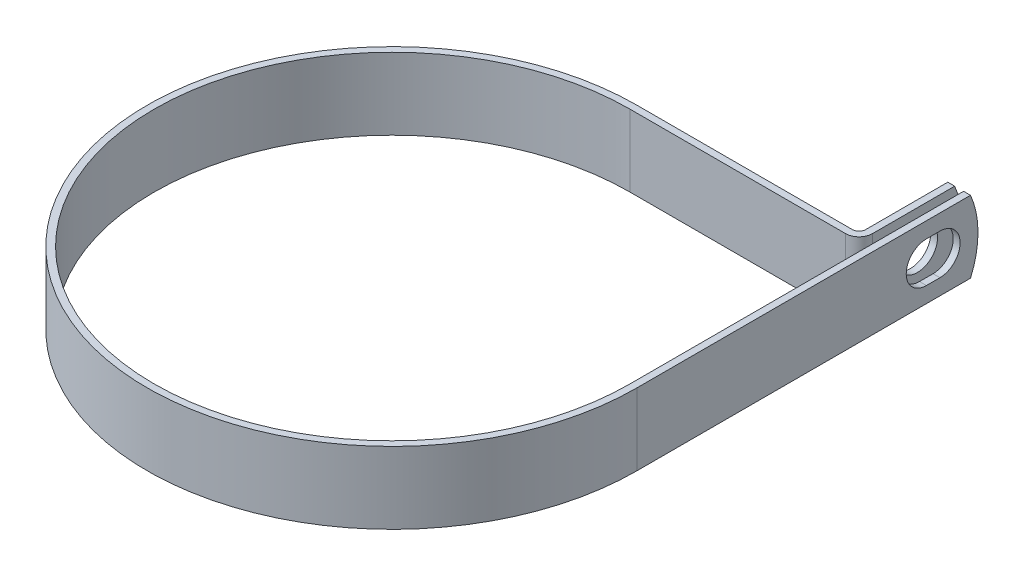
SolidWorks part; units mm, degrees
ref_plane "Front Plane" through (0, 0, 0) normal (0, 0, 1) x (1, 0, 0)
ref_plane "Top Plane" through (0, 0, 0) normal (0, 1, 0) x (1, 0, 0)
ref_plane "Right Plane" through (0, 0, 0) normal (1, 0, 0) x (0, 0, -1)
sketch "Sketch1" plane through (0, 0, 0) normal (0, 1, 0) x (1, 0, 0)
  line L0 (0, 42.0624) -> (38.1102, 42.0624)
  line L1 (42.0624, 0) -> (42.0624, 42.0624)
  line L2 (40.4876, 60.2996) -> (40.4876, 44.4398)
  line L5 (42.0624, 42.0624) -> (42.0624, 60.2996)
  arc A0 (0, 42.0624) -> (42.0624, 0) centre (0, 0) ccw
  arc A3 (38.1102, 42.0624) -> (40.4876, 44.4398) centre (38.1102, 44.4398) ccw
extrude "Extrude-Thin1" add sketch "Sketch1" along normal mid plane 12.7 thin
sketch "Sketch2" plane through (39.2684, 0, 0) normal (-1, 0, 0) x (0, 0, 1)
  line L0 (-60.2996, 6.35) -> (-60.2996, -6.35) construction
  line L7 (0, 6.35) -> (0, -6.35) construction
  circle A0 centre (-52.3748, 0) radius 3.5687
  point P2 (-60.2996, 0)
extrude "Cut-Extrude1" cut sketch "Sketch2" against normal up to surface (1.2192 mm away)
sketch "Sketch3" plane through (43.2816, 0, 0) normal (1, 0, 0) x (0, 0, -1)
  line L0 (51.181, 0) -> (53.5686, 0) construction
  line L1 (51.181, 3.5687) -> (53.5686, 3.5687)
  line L2 (51.181, -3.5687) -> (53.5686, -3.5687)
  line L3 (60.2996, 6.35) -> (60.2996, -6.35) construction
  arc A0 (51.181, 3.5687) -> (51.181, -3.5687) centre (51.181, 0) ccw
  arc A1 (53.5686, -3.5687) -> (53.5686, 3.5687) centre (53.5686, 0) ccw
  point P3 (52.3748, 0)
  point P8 (60.2996, 0)
  point P11 (47.6123, 0)
  point P12 (57.1373, 0)
extrude "Cut-Extrude2" cut sketch "Sketch3" against normal up to surface (1.2192 mm away)
sketch "Sketch4" plane through (39.2684, 0, 0) normal (-1, 0, 0) x (0, 0, 1)
  line L0 (-60.2996, 6.35) -> (-60.2996, -6.35)
  line L1 (-60.2996, 6.35) -> (-58.9743, 6.35)
  line L2 (-60.2996, 6.35) -> (-44.4398, 6.35) construction
  line L3 (-60.2996, -6.35) -> (-58.9743, -6.35)
  line L4 (-60.2996, -6.35) -> (-44.4398, -6.35) construction
  arc A0 (-58.9743, 6.35) -> (-58.9743, -6.35) centre (-44.4246, 0) ccw
extrude "Cut-Extrude3" cut sketch "Sketch4" against normal through all contours A0 M4 M5 | A0 L0 M2
equation "\"D1@Sketch3\" = \"D2@Sketch2\""
equation "\"D7@Sketch1\" = \"D3@Sketch2\" + \"D1@Sketch3\""
equation "\"D1@Sketch4\" = ( \"D1@Extrude-Thin1\" + .125 ) * 2"
equation "\"D2@Sketch1\"=1.95*\"D5@Extrude-Thin1\""
equation "\"D2@Sketch3\" = \"D1@Sketch2\""
